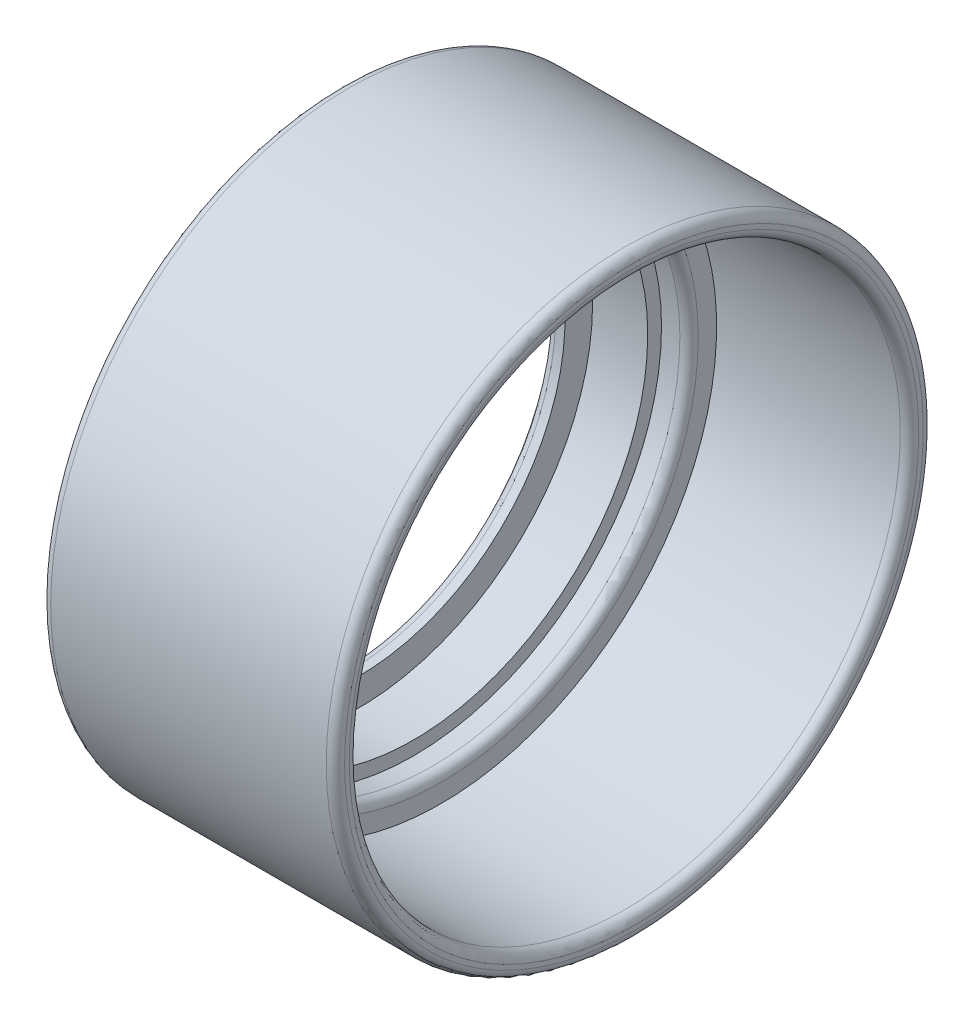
SolidWorks part; units mm, degrees
ref_plane "Front" through (0, 0, 0) normal (0, 0, 1) x (1, 0, 0)
ref_plane "Top" through (0, 0, 0) normal (0, 1, 0) x (1, 0, 0)
ref_plane "Right" through (0, 0, 0) normal (1, 0, 0) x (0, 0, -1)
sketch "Sketch1" plane through (0, 0, 0) normal (0, 0, 1) x (1, 0, 0)
  line L0 (-93.9045, 0) -> (81.8654, 0) construction
  line L1 (1, 22.5) -> (2, 22.5)
  line L2 (2, 22.5) -> (2, 25.5)
  line L3 (2, 25.5) -> (8, 25.5)
  line L4 (8, 25.5) -> (8, 27)
  line L5 (8, 27) -> (10, 27)
  line L6 (11, 28) -> (11, 30)
  line L7 (11, 30) -> (31, 30)
  line L8 (32, 31) -> (32, 31.5)
  line L9 (0, 23.5) -> (0, 31.5)
  line L10 (1, 32.5) -> (31, 32.5)
  arc A0 (0, 31.5) -> (1, 32.5) centre (1, 31.5) cw
  arc A1 (32, 31.5) -> (31, 32.5) centre (31, 31.5) ccw
  arc A2 (31, 30) -> (32, 31) centre (31, 31) ccw
  arc A3 (10, 27) -> (11, 28) centre (10, 28) ccw
  arc A4 (1, 22.5) -> (0, 23.5) centre (1, 23.5) cw
  point P17 (32, 32.5)
  point P20 (32, 30)
  point P23 (11, 27)
  point P26 (0, 22.5)
  dimension "D10" = 1
  dimension "D1" = 45
  dimension "D2" = 51
  dimension "D3" = 54
  dimension "D4" = 60
  dimension "D5" = 65
  dimension "D6" = 2
  dimension "D7" = 6
  dimension "D8" = 3
  dimension "D9" = 21
revolve "Revolve2" add sketch "Sketch1" angle 360 about L0
